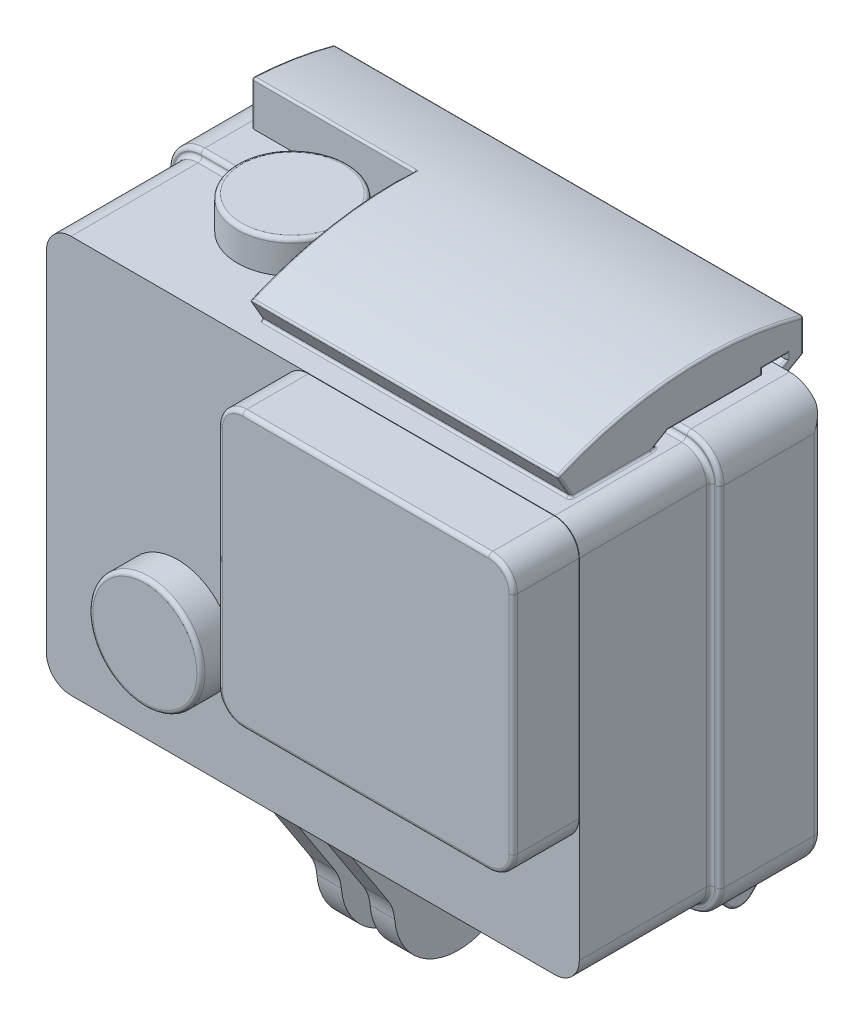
SolidWorks part; units mm, degrees
ref_plane "Plan de face" through (0, 0, 0) normal (0, 0, 1) x (1, 0, 0)
ref_plane "Plan de dessus" through (0, 0, 0) normal (0, 1, 0) x (1, 0, 0)
ref_plane "Plan de droite" through (0, 0, 0) normal (1, 0, 0) x (0, 0, -1)
sketch "Esquisse1" plane through (0, 0, 0) normal (0, 0, 1) x (1, 0, 0)
  line L1 (0, 0) -> (65, 0)
  line L2 (0, 0) -> (0, 48.5)
  line L3 (0, 48.5) -> (65, 48.5)
  line L4 (65, 0) -> (65, 48.5)
  dimension "D1" = 48.5
  dimension "D2" = 65
extrude "Boss.-Extru.1" add sketch "Esquisse1" along normal blind 16
sketch "Esquisse2" plane through (0, 0, 16) normal (0, 0, 1) x (1, 0, 0)
  line L1 (64.95, 48.45) -> (28.95, 48.45)
  line L2 (64.95, 48.45) -> (64.95, 14.95)
  line L3 (64.95, 14.95) -> (28.95, 14.95)
  line L4 (28.95, 48.45) -> (28.95, 14.95)
  line L6 (65, 48.5) -> (0, 48.5) construction
  line L7 (65, 0) -> (65, 48.5) construction
  dimension "D1" = 36
  dimension "D2" = 33.5
  dimension "D3" = 0.05
  dimension "D4" = 0.05
extrude "Boss.-Extru.2" add sketch "Esquisse2" along normal blind 8
sketch "Esquisse3" plane through (0, 0, 0) normal (0, 0, -1) x (-1, 0, 0)
  line L0 (-65, 48.5) -> (-65, 49.5) construction
  line L1 (-66.15, 49.5) -> (1.15, 49.5)
  line L2 (-66.15, 49.5) -> (-66.15, -1)
  line L3 (-66.15, -1) -> (1.15, -1)
  line L4 (1.15, 49.5) -> (1.15, -1)
  line L7 (-65, 0) -> (-65, -1) construction
  line L10 (0, 48.5) -> (1.15, 48.5) construction
  line L13 (-65, 48.5) -> (-66.15, 48.5) construction
  dimension "D1" = 50.5
  dimension "D2" = 67.3
extrude "Boss.-Extru.3" add sketch "Esquisse3" along normal blind 12.5
sketch "Esquisse4" plane through (0, 0, 16) normal (0, 0, 1) x (1, 0, 0)
  line L0 (0, 48.5) -> (0, 0) construction
  line L1 (0, 0) -> (65, 0) construction
  circle A0 centre (16, 14) radius 6.85
  dimension "D1" = 13.7
  dimension "D2" = 16
  dimension "D3" = 14
extrude "Boss.-Extru.4" add sketch "Esquisse4" along normal blind 4
sketch "Esquisse5" plane through (0, 0, 0) normal (-1, 0, 0) x (0, 0, 1)
  line L0 (16, 0) -> (0, 0) construction
  line L1 (16, 48.5) -> (16, 0) construction
  circle A0 centre (2, 14) radius 6.7
  dimension "D1" = 13.4
  dimension "D2" = 14
  dimension "D3" = 14
extrude "Boss.-Extru.5" add sketch "Esquisse5" along normal blind 5
sketch "Esquisse6" plane through (0, 48.5, 0) normal (0, 1, 0) x (1, 0, 0)
  line L0 (65, -16) -> (0, -16) construction
  line L1 (0, -16) -> (0, 0) construction
  circle A0 centre (16, -2) radius 6.7
  dimension "D1" = 13.4
  dimension "D2" = 14
  dimension "D3" = 16
extrude "Boss.-Extru.6" add sketch "Esquisse6" along normal blind 4
sketch "Esquisse8" plane through (66.15, 0, 0) normal (1, 0, 0) x (0, 0, -1)
  line L0 (12.5, -1) -> (0, -1) construction
  line L1 (12.5, 49.5) -> (12.5, -1) construction
  line L2 (12.5, -1) -> (8, -1)
  line L3 (8, -1) -> (8, -1.1135)
  line L4 (12.5, -1) -> (8.8897, -4.4883)
  arc A0 (8, -1.1135) -> (8.8897, -4.4883) centre (7.5, -3.05) ccw
  dimension "D1" = 4
  dimension "D2" = 2.05
  dimension "D3" = 5
  dimension "D4" = 4.5
extrude "Boss.-Extru.8" add sketch "Esquisse8" against normal through all
ref_plane "Plan1" through (32.5, 0, 0) normal (1, 0, 0) x (0, 0, -1)
sketch "Esquisse9" plane through (32.5, 0, 0) normal (1, 0, 0) x (0, 0, -1)
  line L0 (-16, 0) -> (0, 0) construction
  line L1 (-16, 0) -> (-16, 48.5) construction
  line L2 (4.8, -8.5) -> (4.8, 0)
  line L3 (4.8, 0) -> (-16, 0)
  line L4 (-16, 0) -> (-10.784, -8)
  circle A0 centre (-3, -8.5) radius 2.5
  arc A1 (-10.784, -8) -> (4.8, -8.5) centre (-3, -8.5) ccw
  dimension "D1" = 5
  dimension "D2" = 8.5
  dimension "D4" = 15.6
  dimension "D3" = 13
  dimension "D5" = 8
extrude "Boss.-Extru.9" add sketch "Esquisse9" along normal mid plane 9.5
sketch "Esquisse10" plane through (32.5, 0, 0) normal (1, 0, 0) x (0, 0, -1)
  line L0 (4.8, -8.5) -> (4.8, 0) construction
  line L1 (4.8, 0) -> (-16, 0) construction
  line L2 (-16, 0) -> (-10.784, -8) construction
  line L3 (4.8, -8.5) -> (4.8, 0)
  line L4 (4.8, 0) -> (-16, 0)
  line L5 (-16, 0) -> (-10.784, -8)
  circle A0 centre (-3, -8.5) radius 2.5 construction
  arc A1 (-10.784, -8) -> (4.8, -8.5) centre (-3, -8.5) ccw construction
  circle A2 centre (-3, -8.5) radius 2.5
  arc A3 (-10.784, -8) -> (4.8, -8.5) centre (-3, -8.5) ccw
extrude "Enlèv. mat.-Extru.1" cut sketch "Esquisse10" against normal mid plane 3.5
sketch "Esquisse11" plane through (66.15, 0, 0) normal (1, 0, 0) x (0, 0, -1)
  line L0 (12.5, 48) -> (15.2, 49.5588)
  line L1 (12.5, 49.5) -> (12.5, -1) construction
  line L2 (15.2, 49.5588) -> (15.2, 53.5588)
  line L3 (12.5, 48) -> (12.5, 49.5)
  line L4 (12.5, 49.5) -> (13.2, 49.9041)
  line L5 (13.2, 49.9041) -> (13.2, 50.5)
  line L6 (13.2, 50.5) -> (10.2, 50.5)
  line L7 (10.2, 50.5) -> (10.2, 49.75)
  line L8 (10.2, 49.75) -> (-1.3, 49.75)
  line L9 (-1.3, 49.75) -> (-3.4651, 48.5)
  line L10 (-16, 48.5) -> (0, 48.5) construction
  line L11 (-3.4651, 48.5) -> (-13.0679, 48.5)
  line L12 (-13.0679, 48.5) -> (-14.8, 51.5)
  line L13 (12.5, 49.5) -> (0, 49.5) construction
  line L14 (-24, 14.95) -> (-24, 48.45) construction
  line L15 (8, -1) -> (0, -1) construction
  arc A0 (15.2, 53.5588) -> (-14.8, 51.5) centre (3.1228, 9.9412) ccw
  dimension "D12" = 56.2
  dimension "D1" = 0.25
  dimension "D2" = 30
  dimension "D3" = 1.5
  dimension "D4" = 60
  dimension "D5" = 39.2
  dimension "D6" = 30
  dimension "D7" = 2
  dimension "D8" = 1
  dimension "D9" = 3
  dimension "D10" = 11.5
  dimension "D11" = 3
  dimension "D13" = 4
extrude "Boss.-Extru.10" add sketch "Esquisse11" against normal blind 42.5
sketch "Esquisse12" plane through (23.65, 0, 0) normal (-1, 0, 0) x (0, 0, 1)
  line L0 (-5.2, 49.75) -> (-5.2, 55.1523)
  line L11 (-12.5, 48) -> (-12.5, 49.5)
  line L12 (-12.5, 49.5) -> (-13.2, 49.9041)
  line L13 (-13.2, 49.9041) -> (-13.2, 50.5)
  line L14 (-13.2, 50.5) -> (-10.2, 50.5)
  line L15 (-10.2, 50.5) -> (-10.2, 49.75)
  line L16 (-10.2, 49.75) -> (1.3, 49.75)
  line L17 (1.3, 49.75) -> (3.4651, 48.5)
  line L18 (3.4651, 48.5) -> (13.0679, 48.5)
  line L19 (13.0679, 48.5) -> (14.8, 51.5)
  line L20 (-15.2, 53.5588) -> (-15.2, 49.5588)
  line L21 (-15.2, 49.5588) -> (-12.5, 48)
  line L22 (-12.5, 48) -> (-12.5, 49.5)
  line L23 (-12.5, 49.5) -> (-13.2, 49.9041)
  line L24 (-13.2, 49.9041) -> (-13.2, 50.5)
  line L25 (-13.2, 50.5) -> (-10.2, 50.5)
  line L26 (-10.2, 50.5) -> (-10.2, 49.75)
  line L27 (-10.2, 49.75) -> (-5.2, 49.75)
  line L31 (-15.2, 53.5588) -> (-15.2, 49.5588)
  line L32 (-15.2, 49.5588) -> (-12.5, 48)
  arc A1 (14.8, 51.5) -> (-15.2, 53.5588) centre (-3.1228, 9.9412) ccw
  arc A2 (-5.2, 55.1523) -> (-15.2, 53.5588) centre (-3.1228, 9.9412) ccw
  dimension "D2" = 10
  dimension "D1" = 0
extrude "Boss.-Extru.11" add sketch "Esquisse12" along normal offset from surface (19.8 mm away) 5
sketch "Esquisse14" plane through (66.15, 0, 0) normal (1, 0, 0) x (0, 0, -1)
  line L0 (-13.0679, 48.5) -> (-14.8, 51.5) construction
  line L1 (15.2, 49.5588) -> (15.2, 53.5588) construction
  line L2 (12.5, 48) -> (15.2, 49.5588) construction
  line L3 (12.5, 48) -> (12.5, 49.5) construction
  line L4 (12.5, 49.5) -> (13.2, 49.9041) construction
  line L5 (13.2, 49.9041) -> (13.2, 50.5) construction
  line L6 (13.2, 50.5) -> (10.2, 50.5) construction
  line L7 (10.2, 50.5) -> (10.2, 49.75) construction
  line L8 (10.2, 49.75) -> (-1.3, 49.75) construction
  line L9 (-1.3, 49.75) -> (-3.4651, 48.5) construction
  line L10 (-3.4651, 48.5) -> (-13.0679, 48.5) construction
  line L11 (-13.0679, 48.5) -> (-14.8, 51.5)
  line L12 (15.2, 49.5588) -> (15.2, 53.5588)
  line L13 (12.5, 48) -> (15.2, 49.5588)
  line L14 (12.5, 48) -> (12.5, 49.5)
  line L15 (12.5, 49.5) -> (13.2, 49.9041)
  line L16 (13.2, 49.9041) -> (13.2, 50.5)
  line L17 (13.2, 50.5) -> (10.2, 50.5)
  line L18 (10.2, 50.5) -> (10.2, 49.75)
  line L19 (10.2, 49.75) -> (-1.3, 49.75)
  line L20 (-1.3, 49.75) -> (-3.4651, 48.5)
  line L21 (-3.4651, 48.5) -> (-13.0679, 48.5)
  line L22 (12.5, -1) -> (8, -1) construction
  line L23 (8, -1) -> (8, -1.1135) construction
  line L24 (12.5, -1) -> (8.8897, -4.4883) construction
  line L25 (12.5, -1) -> (8, -1)
  line L26 (8, -1) -> (8, -1.1135)
  line L27 (12.5, -1) -> (8.8897, -4.4883)
  arc A0 (15.2, 53.5588) -> (-14.8, 51.5) centre (3.1228, 9.9412) ccw construction
  arc A1 (15.2, 53.5588) -> (-14.8, 51.5) centre (3.1228, 9.9412) ccw
  arc A2 (8, -1.1135) -> (8.8897, -4.4883) centre (7.5, -3.05) ccw construction
  arc A3 (8, -1.1135) -> (8.8897, -4.4883) centre (7.5, -3.05) ccw
extrude "Enlèv. mat.-Extru.2" cut sketch "Esquisse14" against normal offset from surface (5 mm away) 5
sketch "Esquisse15" plane through (-5, 0, 0) normal (-1, 0, 0) x (0, 0, 1)
  line L3 (-12.5, -1) -> (-8.8897, -4.4883)
  line L4 (-8, -1.1135) -> (-8, -1)
  line L5 (-8, -1) -> (-12.5, -1)
  line L6 (-12.5, -1) -> (-8.8897, -4.4883)
  line L7 (-8, -1.1135) -> (-8, -1)
  line L8 (-8, -1) -> (-12.5, -1)
  arc A1 (-8.8897, -4.4883) -> (-8, -1.1135) centre (-7.5, -3.05) ccw
  arc A2 (-8.8897, -4.4883) -> (-8, -1.1135) centre (-7.5, -3.05) ccw
  dimension "D1" = 0
extrude "Enlèv. mat.-Extru.3" cut sketch "Esquisse15" against normal up to surface (8.85 mm away)
fillet "Congé1" radius 0.25 6 edges at (42.4, 51.5, 14.8) (23.65, 54.4637, 5.0077) (13.75, 55.1523, -5.2) (3.85, 54.6361, -10.2447) (32.5, 53.5588, -15.2) (61.15, 55.0938, -0.024)
fillet "Congé3" radius 0.25 24 edges at (42.4, 48.5, 3.4651) (42.4, 48.5, 13.0679) (3.8822, 55.0231, -5.2385) (3.9458, 53.5172, -15.1508) (61.0542, 53.5172, -15.1508) (61.1178, 51.4083, 14.6911) (3.85, 52.3199, -5.2) (3.85, 49.75, -7.7) (3.85, 50.125, -10.2) (3.85, 50.5, -11.7) (3.85, 50.2021, -13.2) (3.85, 49.7021, -12.85) (3.85, 48.7794, -13.85) (3.85, 51.4291, -15.2) (61.15, 50.125, -10.2) (61.15, 50.5, -11.7) (61.15, 50.2021, -13.2) (61.15, 49.7021, -12.85) (61.15, 48.7794, -13.85) (61.15, 51.4291, -15.2) (61.15, 49.75, -4.45) (61.15, 49.125, 2.3825) (61.15, 48.5, 8.2665) (61.15, 49.878, 13.8635)
fillet "Congé4" radius 0.5 4 edges at (46.95, 14.95, 24) (28.95, 31.7, 24) (46.95, 48.45, 24) (64.95, 31.7, 24)
fillet "Congé5" radius 0.5 3 edges at (-5, 14, 8.7) (22.85, 14, 20) (16, 52.5, 8.7)
fillet "Congé6" radius 3 8 edges at (64.8036, 48.3036, 23.8536) (64.8036, 15.0964, 23.8536) (29.0964, 48.3036, 23.8536) (29.0964, 15.0964, 23.8536) (28.95, 14.95, 19.75) (28.95, 48.45, 19.75) (64.95, 14.95, 19.75) (64.95, 48.45, 19.75)
fillet "Congé7" radius 3 4 edges at (0, 0, 8) (0, 48.5, 8) (65, 0, 8) (65, 48.5, 8)
fillet "Congé8" radius 4 4 edges at (-1.15, 49.5, -6.25) (66.15, 49.5, -6.25)
fillet "Congé12" radius 0.5 32 edges at (37.25, -1, -2.4) (27.75, -1, -2.4) (16, 49.5, -4.7) (-1.15, 14, -4.7) (37.25, -0.5, 0) (49.625, 0, 0) (64.1213, 0.8787, 0) (65, 24.25, 0) (64.1213, 47.6213, 0) (42.1973, 48.5, 0) (22.3945, 49, 0) (9.6055, 49, 0) (42.2723, 49.5, 0) (64.9784, 48.3284, 0) (66.15, 24.25, 0) (64.9784, 0.1716, 0) (49.7, -1, 0) (-0.575, 20.3945, 0) (-0.575, 7.6055, 0) (0, 5.3027, 0) (0.8787, 0.8787, 0) (15.375, 0, 0) (27.75, -0.5, 0) (15.3, -1, 0) (0.0216, 0.1716, 0) (-1.15, 5.3027, 0) (6.3027, 48.5, 0) (0.8787, 47.6213, 0) (0, 32.9473, 0) (-1.15, 32.9473, 0) (0.0216, 48.3284, 0) (6.2277, 49.5, 0)
fillet "Congé15" radius 1 1 edges
fillet "Congé17" radius 0.25 6 edges at (61.15, -3.5598, -5.5661) (61.15, -1.157, -12.3136) (3.85, -1.157, -12.3136) (3.85, -3.5598, -5.5661) (61.15, -2.8916, -10.5423) (3.85, -2.8916, -10.5423)
fillet "Congé20" radius 1 4 edges at (65.5538, 0.899, -12.5) (-0.5538, 0.899, -12.5) (66.15, 24.25, -12.5)
fillet "Congé26" radius 5 2 edges at (29.25, -8, 10.784) (35.75, -8, 10.784)
